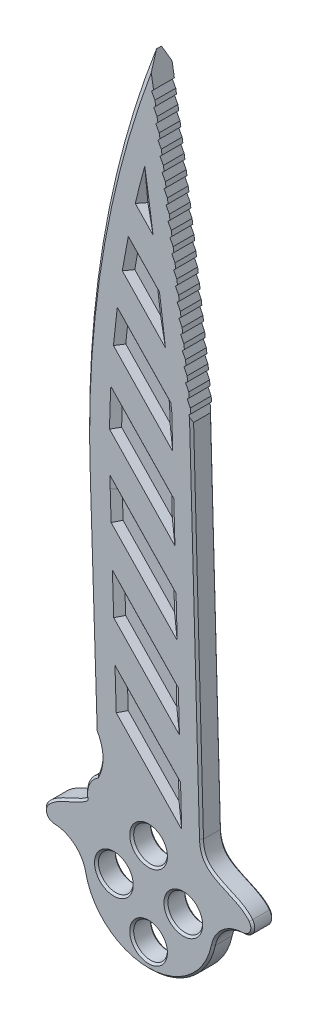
SolidWorks part; units mm, degrees
ref_plane "Front Plane" through (0, 0, 0) normal (0, 0, 1) x (1, 0, 0)
ref_plane "Top Plane" through (0, 0, 0) normal (0, 1, 0) x (1, 0, 0)
ref_plane "Right Plane" through (0, 0, 0) normal (1, 0, 0) x (0, 0, -1)
sketch "Reference" plane through (0, 0, 0) normal (0, 0, 1) x (1, 0, 0)
  point P0 (0, 0)
  line B0 (-10.2142, 51.0044) -> (-8.9005, 18.3814)
  line B1 (5.6892, 64.2668) -> (7.8499, 10.6107)
  line B2 (5.145, 0) -> (-5.145, 0) construction
  line B3 (0, 6.3084) -> (0, -6.3083) construction
  line B4 (-0.8028, 101.2922) -> (0, 0) construction
  circle B5 centre (0, -6.3083) radius 2.1
  circle B6 centre (0, 6.3084) radius 2.1
  circle B7 centre (5.145, 0) radius 2.6256
  circle B8 centre (-5.145, 0) radius 2.6267
  arc B9 (-15.5246, 4.0504) -> (-14.276, 1.7711) centre (-14.276, 3.2527) ccw
  arc B10 (14.2811, 1.7711) -> (15.5309, 3.9808) centre (14.2811, 3.2294) ccw
  arc B11 (-0.8028, 101.2922) -> (5.6892, 64.2668) centre (-445.4476, 4.2456) cw
  arc B12 (-9.9147, -1.5487) -> (9.9147, -1.5487) centre (0, 0) ccw
  arc B13 (-0.8028, 101.2922) -> (-10.2142, 51.0044) centre (104.2201, 55.6126) ccw
  arc B14 (-8.9005, 18.3814) -> (-7.9042, 11.5574) centre (-13.5787, 14.2136) cw
  arc B15 (-7.9042, 11.5574) -> (-9.4311, 7.8007) centre (-5.8692, 8.5417) ccw
  arc B16 (-14.276, 1.7711) -> (-9.9147, -1.5487) centre (-14.4451, -2.9758) cw
  spline B17 degree 3 poles (7.8499, 10.6107) (7.9441, 8.272) (11.5242, 6.4352) (14.8276, 5.1505) (15.5309, 3.9808) knots 0 0 0 0 0.596349 1 1 1 1
  spline B18 degree 3 poles (-15.5246, 4.0504) (-14.2402, 6.0608) (-10.9046, 6.1628) (-9.4311, 7.8007) knots 0 0 0 0 1 1 1 1
  spline B19 degree 2 poles (14.2811, 1.7711) (11.0586, 1.5219) (9.9147, -1.5487) knots 0 0 0 1 1 1
sketch_block_instance "Block1-1"
sketch_block "Block1"
sketch "Sketch2" plane through (0, 0, 0) normal (0, 0, 1) x (1, 0, 0)
  line L0 (0, 0) -> (0, 110) construction
  line L1 (-10, 50) -> (-9, 18.5)
  line L2 (6.5, 65) -> (8, 11)
  line L3 (-5.25, 0) -> (5.25, 0) construction
  arc A0 (0, 110) -> (6.5, 65) centre (-788.2129, -26.8224) cw
  arc A1 (0, 110) -> (-10, 50) centre (139.8858, 55.8524) ccw
  circle A3 centre (5.25, 0) radius 2.625
  circle A4 centre (-5.25, 0) radius 2.625
  circle A5 centre (0, 6.3) radius 2.55
  circle A6 centre (0, -6.3) radius 2.55
  arc A7 (14.25, 1.75) -> (15.4301, 4.1759) centre (14.25, 3.25) ccw
  arc A8 (-14.25, 1.75) -> (-15.4301, 4.1759) centre (-14.25, 3.25) cw
  arc A9 (-9.7969, -2.0051) -> (9.7969, -2.0051) centre (0, 0) ccw
  arc A10 (-7.8284, 11.5695) -> (-9.4491, 7.7619) centre (-5.9, 8.5) ccw
  arc A12 (-7.8284, 11.5695) -> (-9, 18.5) centre (-13.0562, 14.25) ccw
  arc A13 (14.25, 1.75) -> (9.7969, -2.0051) centre (14.4015, -2.9476) ccw
  arc A14 (-14.25, 1.75) -> (-9.7969, -2.0051) centre (-14.4015, -2.9476) cw
  spline S0 degree 3 poles (8, 11) (8.0301, 9.9148) (8.696, 7.6489) (12.4165, 6.3119) (14.7596, 5.0305) (15.4301, 4.1759) knots 0 0 0 0 0.252714 0.691888 1 1 1 1
  spline S1 degree 3 poles (-9.4491, 7.7619) (-10.3526, 7.0461) (-12.7215, 6.1451) (-14.7596, 5.0305) (-15.4301, 4.1759) knots 0.349978 0.349978 0.349978 0.349978 0.691888 1 1 1 1
  point P3 (6.5, 65)
  dimension "D2" = 65
  dimension "D4" = 800
  dimension "D5" = 150
  dimension "D12" = 5.25
  dimension "D13" = 5.25
  dimension "D14" = 5.1
  dimension "D15" = 6.3
  dimension "D16" = 14.25
  dimension "D17" = 3.25
  dimension "D18" = 3
  dimension "D19" = 20
  dimension "D20" = 8.5
  dimension "D22" = 7.25
  dimension "D23" = 11.75
  dimension "D25" = 4.7
  dimension "D1" = 110
  dimension "D3" = 6.5
  dimension "D6" = 10
  dimension "D7" = 60
  dimension "D8" = 9
  dimension "D9" = 18.5
  dimension "D10" = 11
  dimension "D11" = 8
  dimension "D21" = 5.9
  dimension "D24" = 14.25
extrude "Boss-Extrude1" add sketch "Sketch2" along normal blind 3.15
chamfer "Chamfer1" distance 1.2 angle 45 2 edges at (-8.0733, 80.5122, 0) (-8.0733, 80.5122, 3.15)
sketch "Sketch4" plane through (0, 0, 3.15) normal (0, 0, 1) x (1, 0, 0)
  line L0 (-2.0117, 89.3599) -> (0.6832, 86.5438)
  line L2 (-3.0652, 84.5346) -> (1.6487, 79.6086)
  line L3 (-3.9742, 79.5583) -> (2.5429, 72.748)
  line L4 (-4.7273, 74.419) -> (3.3681, 65.9594)
  line L5 (-5.3109, 69.1027) -> (3.6448, 59.7439)
  line L6 (5.0012, 10.9167) -> (3.5048, 64.7857)
  line L7 (5.0012, 10.9167) -> (3.5048, 64.7857)
  line L8 (-5.7087, 63.5921) -> (3.8144, 53.6405)
  line L9 (-5.9004, 57.8662) -> (3.9839, 47.5371)
  line L10 (-5.8607, 51.8985) -> (4.1535, 41.4337)
  line L11 (-5.8023, 50.1376) -> (-4.7456, 16.8546)
  line L12 (-5.8023, 50.1376) -> (-4.8851, 21.2479)
  line L13 (-5.6635, 45.7662) -> (4.323, 35.3303)
  line L14 (-5.4689, 39.6366) -> (4.4925, 29.2269)
  line L15 (-5.2743, 33.507) -> (4.6621, 23.1235)
  line L16 (-5.0797, 27.3774) -> (4.8316, 17.0201)
  line L17 (-4.8851, 21.2479) -> (5.0012, 10.9167)
  arc A21 (3.5048, 64.7857) -> (-2.5568, 107.1679) centre (-788.2129, -26.8224) ccw
  arc A22 (3.5048, 64.7857) -> (-0.5719, 94.9585) centre (-788.2129, -26.8224) ccw
  spline S4 degree 3 poles (3.2127, 106.6275) (-3.515, 88.5184) (-6.5594, 69.4413) (-5.8023, 50.1376) knots 0 0 0 0 1 1 1 1 weights 1 0.987046 0.987046 1
  spline S5 degree 3 poles (3.2127, 106.6275) (-3.515, 88.5184) (-6.5594, 69.4413) (-5.8023, 50.1376) knots 0 0 0 0 1 1 1 1 weights 1 0.987046 0.987046 1
  dimension "D3" = 13
  dimension "D1" = 3
  dimension "D2" = 3
extrude "Cut-Extrude1" cut sketch "Sketch4" against normal blind 0.75 draft 55 contours L12 L17 L7 L16 | L12 L15 L7 L14 | L10 S5 L12 L13 L7 | L8 S5 L9 L7 | L4 S5 L5 L7 A22 | L2 S5 L3 A22 | A22 S5 L0
ref_plane "Plane1" through (0, 0, 1.575) normal (0, 0, 1) x (1, 0, 0)
mirror "Mirror1" about plane through (0, 0, 1.575) normal (0, 0, 1) of "Cut-Extrude1"
sketch "Sketch5" plane through (0, 0, 3.15) normal (0, 0, 1) x (1, 0, 0)
  line L2 (0.8376, 105.6891) -> (0.4456, 105.3042)
  line L6 (0.4456, 105.3042) -> (1.1046, 104.0891)
  line L7 (1.1046, 104.0891) -> (0.8376, 105.6891)
  arc A6 (0.4991, 107.6891) -> (0.0985, 110.0171) centre (-788.2129, -26.8224) ccw
  arc A7 (6.5993, 65.0115) -> (0.4991, 107.6891) centre (-788.2129, -26.8224) ccw
  arc A8 (0.4991, 107.6891) -> (0.0985, 110.0171) centre (-788.2129, -26.8224) ccw
  arc A9 (6.5993, 65.0115) -> (0.4991, 107.6891) centre (-788.2129, -26.8224) ccw
  dimension "D1" = 0.1
  dimension "D2" = 55
  dimension "D3" = 0.45
  dimension "D4" = 1.6
  dimension "D5" = 2
extrude "Cut-Extrude2" cut sketch "Sketch5" against normal through all contours L2 L6 M35
pattern_curve "CrvPattern1" of "Cut-Extrude2" parameters "D1"=21, "D3"=2, "D2"=1, "D4"=10
chamfer "Chamfer2" distance 0.3 angle 45 8 edges at (-2.55, -6.3, 0) (-7.875, 0, 0) (7.875, 0, 0) (2.55, 6.3, 0) (-2.55, -6.3, 3.15) (7.875, 0, 3.15) (-7.875, 0, 3.15) (2.55, 6.3, 3.15)
chamfer "Chamfer3" distance 0.3 angle 45 20 edges at (7.2528, 37.8982, 0) (15.5989, 2.5938, 0) (-11.3716, 0.6455, 0) (11.3716, 0.6455, 0) (0, -10, 0) (-15.5989, 2.5938, 0) (-9.2354, 9.9197, 0) (-7.182, 14.1547, 0) (7.2528, 37.8982, 3.15) (15.5989, 2.5938, 3.15) (-11.3716, 0.6455, 3.15) (11.3716, 0.6455, 3.15) (0, -10, 3.15) (-15.5989, 2.5938, 3.15) (-9.2354, 9.9197, 3.15) (-7.182, 14.1547, 3.15)
